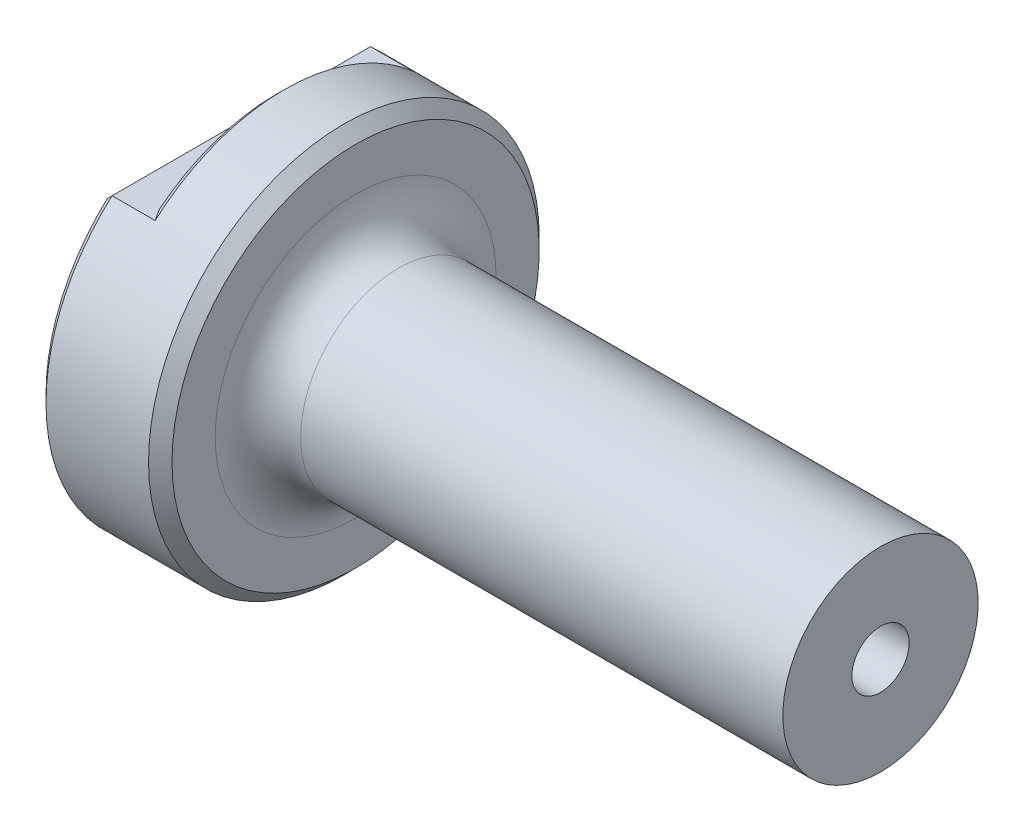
SolidWorks part; units mm, degrees
ref_plane "Front Plane" through (0, 0, 0) normal (0, 0, 1) x (1, 0, 0)
ref_plane "Top Plane" through (0, 0, 0) normal (0, 1, 0) x (1, 0, 0)
ref_plane "Right Plane" through (0, 0, 0) normal (1, 0, 0) x (0, 0, -1)
sketch "Sketch1" plane through (0, 0, 0) normal (1, 0, 0) x (0, 0, -1)
  circle A0 centre (0, 0) radius 25.4
  dimension "Rod Dia" = 50.8
extrude "Boss-Extrude1" add sketch "Sketch1" along normal mid plane 84.1375 contours A0
sketch "Sketch3" plane through (-42.0688, 0, 0) normal (-1, 0, 0) x (0, 0, 1)
  line L1 (-25.4, 25.4) -> (25.4, 25.4)
  line L2 (-25.4, 25.4) -> (-25.4, 19.05)
  line L3 (-25.4, 19.05) -> (25.4, 19.05)
  line L4 (25.4, 25.4) -> (25.4, 19.05)
  line L5 (-25.4, 25.4) -> (25.4, 19.05) construction
  line L6 (-25.4, 19.05) -> (25.4, 25.4) construction
  circle A0 centre (0, 0) radius 25.4 construction
  point P0 (0, 22.225)
  dimension "D1" = 19.05
extrude "Cut-Extrude1" cut sketch "Sketch3" against normal blind 5.588
sketch "Sketch5" plane through (0, 0, 0) normal (0, 0, 1) x (1, 0, 0)
  line L0 (42.0688, 0) -> (-42.0688, 0) construction
  line L1 (42.0688, -25.4) -> (42.0688, 25.4) construction
  line L2 (-42.0688, 19.05) -> (-42.0688, -25.4) construction
  line L3 (-26.1938, -12.7) -> (42.0688, -12.7)
  line L4 (42.0688, -12.7) -> (42.0688, -25.4)
  line L5 (42.0688, -25.4) -> (-26.1938, -25.4)
  line L6 (-42.0688, -25.4) -> (42.0688, -25.4) construction
  line L7 (-26.1938, -25.4) -> (-26.1938, -12.7)
  dimension "B" = 15.875
  dimension "D" = 25.4
revolve "Cut-Revolve1" cut sketch "Sketch5" angle 360 about L0
sketch "Sketch6" plane through (0, 0, 0) normal (0, 0, 1) x (1, 0, 0)
  line L0 (42.0688, 0) -> (-42.0688, 0) construction
  line L1 (42.0688, -12.7) -> (42.0688, 12.7) construction
  line L2 (-42.0688, 19.05) -> (-42.0688, -25.4) construction
  line L3 (-37.446, 0) -> (-42.0688, 0)
  line L5 (-42.0688, 12.4402) -> (-42.0688, 0)
  arc A0 (-42.0688, 12.4402) -> (-37.446, 0) centre (-56.496, 0) cw
  dimension "D1" = 19.05
  dimension "D2" = 4.6228
revolve "Cut-Revolve2" cut sketch "Sketch6" angle 360 about L0
sketch "Sketch7" plane through (0, 0, 0) normal (0, 0, 1) x (1, 0, 0)
  line L0 (-37.5496, 1.9844) -> (42.0688, 3.7217)
  line L2 (42.0688, -12.7) -> (42.0688, 12.7) construction
  line L3 (-37.5496, 0) -> (42.0688, 0)
  line L4 (42.0688, 0) -> (-42.0688, 0) construction
  line L5 (-42.0688, 19.05) -> (-42.0688, -25.4) construction
  line L6 (42.0688, 3.7217) -> (42.0688, 0)
  line L7 (-37.5496, 1.9844) -> (-37.5496, 0)
  line L8 (42.0688, 0) -> (41.1743, 0.1051)
  arc A1 (-42.0688, -12.4402) -> (-42.0688, 12.4402) centre (-56.496, 0) ccw construction
  dimension "D1" = 1.25
  dimension "D2" = 3.9688
revolve "Cut-Revolve3" cut sketch "Sketch7" angle 360 about L4
fillet "Fillet1" radius 5.5562 1 edges at (-26.1938, 12.7, 0)
chamfer "Chamfer1" distance 1.524 angle 45 1 edges at (-26.1938, 25.4, 0)
chamfer "Chamfer2" distance 1.016 angle 45 3 edges at (-36.4807, 25.4, 0) (-42.0688, -25.4, 0) (-42.0688, 19.05, 0)
